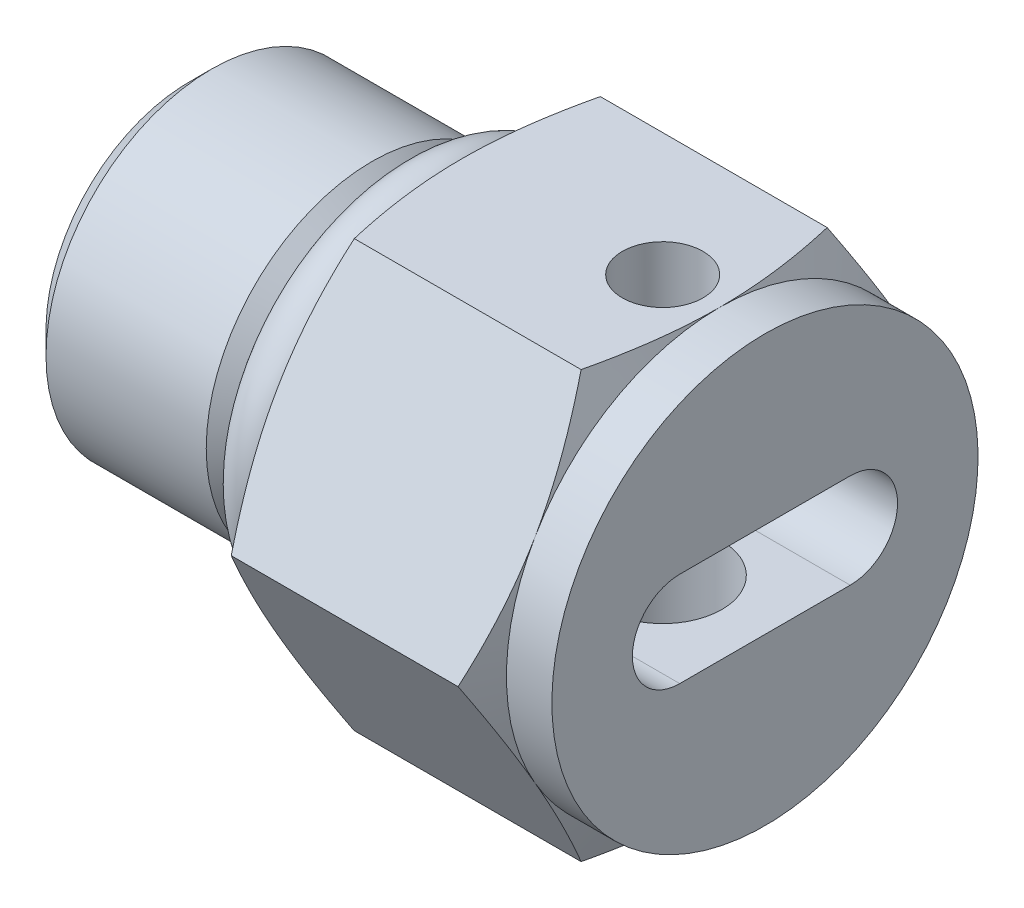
SolidWorks part; units mm, degrees
ref_plane "Front Plane" through (0, 0, 0) normal (0, 0, 1) x (1, 0, 0)
ref_plane "Top Plane" through (0, 0, 0) normal (0, 1, 0) x (1, 0, 0)
ref_plane "Right Plane" through (0, 0, 0) normal (1, 0, 0) x (0, 0, -1)
ref_plane "Plane1" through (0, 0, 0) normal (0, 0, -1) x (-1, 0, 0)
sketch "Sketch1" plane through (0, 0, 0) normal (0, 0, -1) x (-1, 0, 0)
  line L0 (-9.1186, 0) -> (-7.1374, 0) construction
  circle A0 centre (-8.128, 5.588) radius 0.9906
revolve "Revolve1" add sketch "Sketch1" angle 360 about L0
imported_body "Imported3"
sketch "Sketch2" plane through (17.78, 0, 0) normal (1, 0, 0) x (0, 0, -1)
  circle A0 centre (0, 0) radius 7.1437
extrude "Boss-Extrude1" add sketch "Sketch2" along normal blind 1.524
sketch "Sketch3" plane through (9.144, 0, 0) normal (-1, 0, 0) x (0, 0, 1)
  circle A0 centre (0, 0) radius 4.572
extrude "Boss-Extrude2" add sketch "Sketch3" along normal blind 2.032
sketch "Sketch4" plane through (7.112, 0, 0) normal (-1, 0, 0) x (0, 0, 1)
  circle A0 centre (0, 0) radius 4.572
extrude "Boss-Extrude3" add sketch "Sketch4" along normal blind 0.9842 draft 45
sketch "Sketch5" plane through (6.1278, 0, 0) normal (-1, 0, 0) x (0, 0, 1)
  circle A0 centre (0, 0) radius 5.5562
extrude "Boss-Extrude4" add sketch "Sketch5" along normal blind 6.1278
sketch "Sketch7" plane through (0, 0, 0) normal (0, 0, 1) x (1, 0, 0)
  line L0 (0, 2.8804) -> (0, 0)
  line L1 (0, 0) -> (1.7307, 0)
  line L2 (1.7307, 0) -> (0, 2.8804)
  line L3 (0, 0) -> (1.7308, 0) construction
revolve "Cut-Revolve1" cut sketch "Sketch7" angle 360 about L1
chamfer "Chamfer1" distance 0.7556 angle 45 1 edges at (0, -5.5562, 0)
sketch "Sketch8" plane through (19.304, 0, 0) normal (1, 0, 0) x (0, 0, -1)
  line L0 (-2.8575, 0) -> (2.8575, 0) construction
  line L1 (-2.8575, 1.5875) -> (2.8575, 1.5875)
  line L2 (-2.8575, -1.5875) -> (2.8575, -1.5875)
  arc A1 (-2.8575, 1.5875) -> (-2.8575, -1.5875) centre (-2.8575, 0) ccw
  arc A2 (2.8575, -1.5875) -> (2.8575, 1.5875) centre (2.8575, 0) ccw
  point P3 (0, 0)
  dimension "D1" = 8.89
  dimension "D2" = 3.175
extrude "Cut-Extrude1" cut sketch "Sketch8" against normal blind 7.874
hole_wizard "#6-32 Tapped Hole1" positions "Sketch9" profile "Sketch11" tap size "#6-32" standard "ANSI Inch"
sketch "Sketch9" plane through (0, -7.1437, 0) normal (0, -1, 0) x (-1, 0, 0)
  line L0 (-19.304, 0) -> (-15.875, 0) construction
  line L1 (-19.304, 7.1437) -> (-19.304, -7.1438) construction
  point P0 (-15.875, 0)
  dimension "D1" = 1.905
sketch "Sketch11" plane through (15.875, -7.1437, 0) normal (1, 0, 0) x (0, 0, -1)
  line L0 (0, 0) -> (0, 14.2875)
  line L1 (0, 14.2875) -> (1.3525, 14.2875)
  line L2 (1.3525, 14.2875) -> (1.3525, 0)
  line L5 (1.3525, 0) -> (0, 0)
  line L11 (0, -6.35) -> (0, 107.95) construction
  dimension "Thru Tap Drill Dia." = 2.7051
  dimension "Thru Tap Drill Depth" = 14.2875
hole_wizard "5/32 (0.15625) Diameter Hole1" positions "Sketch12" profile "Sketch14" hole size "5/32" standard "ANSI Inch"
sketch "Sketch12" plane through (0, -7.1437, 0) normal (0, -1, 0) x (-1, 0, 0)
  circle A0 centre (-15.875, 0) radius 1.3525 construction
  point P0 (-15.875, 0)
sketch "Sketch14" plane through (15.875, -7.1437, 0) normal (1, 0, 0) x (0, 0, -1)
  line L0 (0, 0) -> (0, 11.43)
  line L1 (0, 11.43) -> (1.9844, 11.43)
  line L2 (1.9844, 11.43) -> (1.9844, 0)
  line L5 (1.9844, 0) -> (0, 0)
  line L10 (0, 11.43) -> (-1.9844, 11.43) construction
  line L11 (0, -6.35) -> (0, 107.95) construction
  dimension "Hole Dia." = 3.9688
  dimension "Hole Depth" = 11.43
  dimension "Drill Angle" = 180
fillet "Fillet1" radius 1.5875 4 edges at (11.43, 1.5875, 0) (11.43, 0, -4.445) (11.43, -1.5875, 0) (11.43, 0, 4.445)
